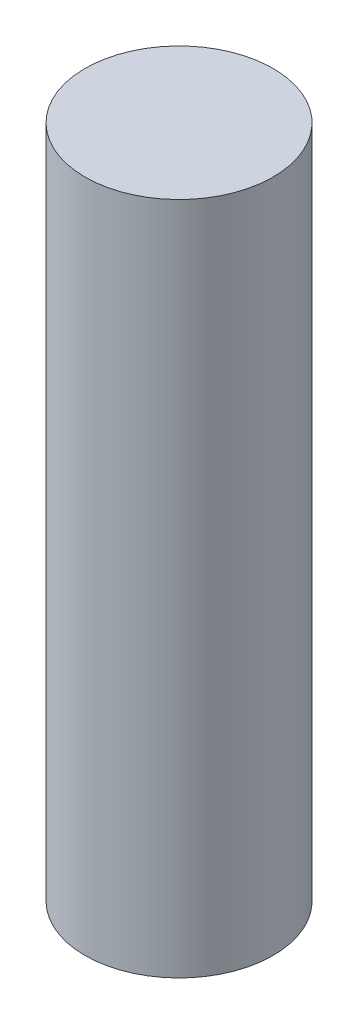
SolidWorks part; units mm, degrees
ref_plane "Front Plane" through (0, 0, 0) normal (0, 0, 1) x (1, 0, 0)
ref_plane "Top Plane" through (0, 0, 0) normal (0, 1, 0) x (1, 0, 0)
ref_plane "Right Plane" through (0, 0, 0) normal (1, 0, 0) x (0, 0, -1)
sketch "Sketch1" plane through (0, 0, 0) normal (0, 1, 0) x (1, 0, 0)
  circle A0 centre (0, 0) radius 30
  dimension "D1" = 60
extrude "Boss-Extrude1" add sketch "Sketch1" along normal blind 215
